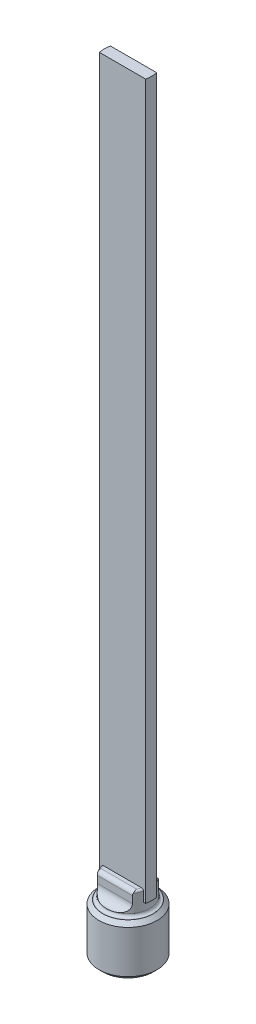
SolidWorks part; units mm, degrees
other "Cut-Extrude1"
ref_plane "Front Plane" through (0, 0, 0) normal (0, 0, 1) x (1, 0, 0)
ref_plane "Top Plane" through (0, 0, 0) normal (0, 1, 0) x (1, 0, 0)
ref_plane "Right Plane" through (0, 0, 0) normal (1, 0, 0) x (0, 0, -1)
imported_body "Imported1"
sketch "Sketch1" plane through (0, 8.001, 0) normal (0, 1, 0) x (1, 0, 0)
  line L0 (-3.0261, 0.7239) -> (3.0261, 0.7239)
  line L1 (3.0261, -0.7239) -> (-3.0261, -0.7239)
  line L2 (2.7643, 0.7239) -> (-2.7643, 0.7239) construction
  line L3 (-2.7643, -0.7239) -> (2.7643, -0.7239) construction
  arc A0 (-3.0261, 0.7239) -> (-3.0261, -0.7239) centre (0, 0) ccw
  arc A1 (3.0261, -0.7239) -> (3.0261, 0.7239) centre (0, 0) ccw
  dimension "D1" = 6.223
extrude "Boss-Extrude1" add sketch "Sketch1" along normal offset from surface (93.599 mm away) 101.6
